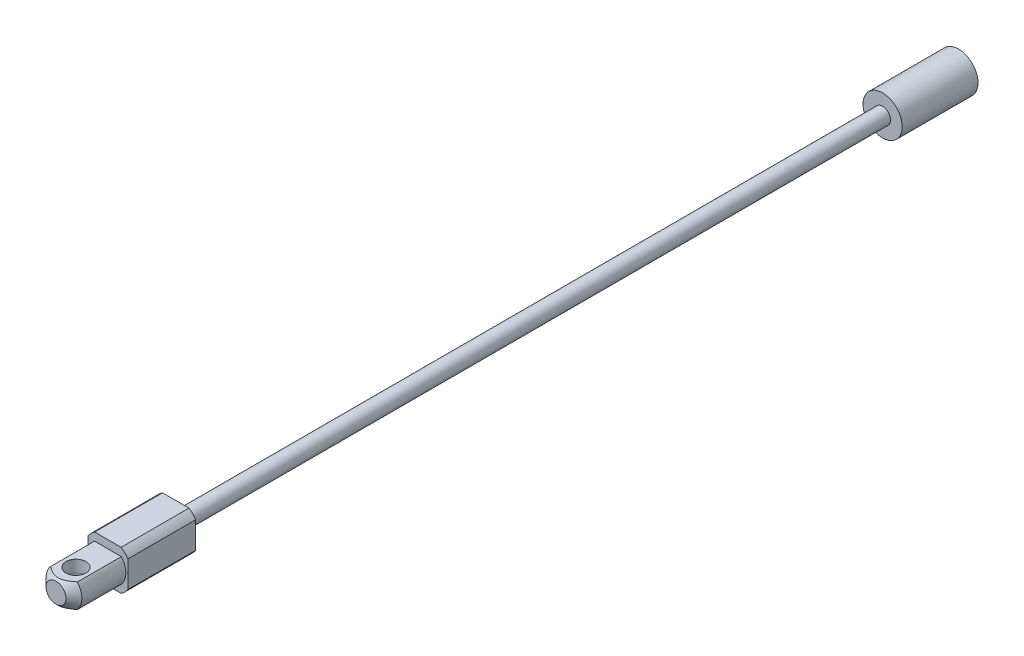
SolidWorks part; units mm, degrees
other "<Left_Piston>-<Split Line1>"
ref_plane "Front Plane" through (0, 0, 0) normal (0, 0, 1) x (1, 0, 0)
ref_plane "Top Plane" through (0, 0, 0) normal (0, 1, 0) x (1, 0, 0)
ref_plane "Right Plane" through (0, 0, 0) normal (1, 0, 0) x (0, 0, -1)
mirrored part "Left_Piston_Mirrored"
sketch "Sketch1" plane through (0, 0, 0) normal (1, 0, 0) x (0, 0, -1)
  line L0 (1158.7117, 0) -> (1171.5146, 0)
sketch "Sketch2" plane through (0, 0, -1423.1964) normal (0, 0, 1) x (1, 0, 0)
  circle A0 centre (0, 0) radius 8.7267
  dimension "D1" = 17.4534
extrude "Extrude1" [suppressed] add sketch "Sketch2" against normal up to surface (24.13 mm away)
sketch "Sketch3" plane through (0, 0, -1423.1964) normal (0, 0, 1) x (1, 0, 0)
  circle A0 centre (0.4987, -0.4575) radius 5.08
  dimension "D1" = 10.16
extrude "Cut-Extrude-Thin1" [suppressed] cut sketch "Sketch3" against normal through all thin
